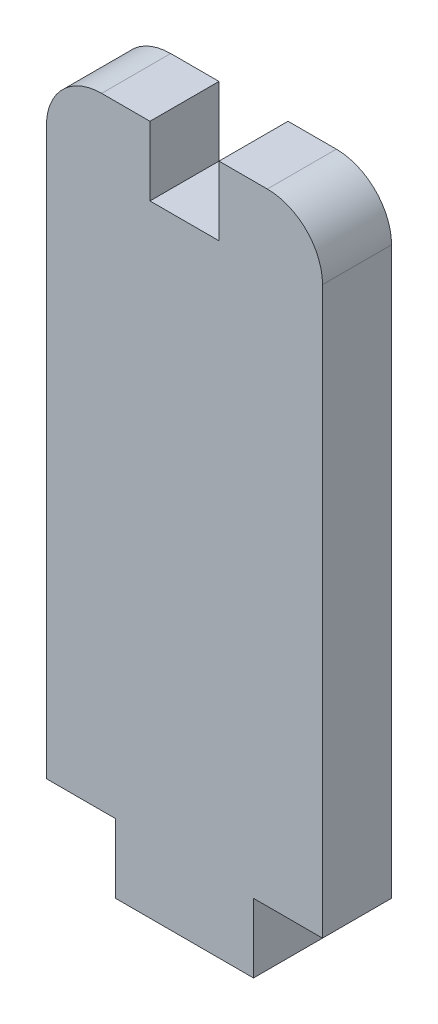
SolidWorks part; units mm, degrees
ref_plane "Front Plane" through (0, 0, 0) normal (0, 0, 1) x (1, 0, 0)
ref_plane "Top Plane" through (0, 0, 0) normal (0, 1, 0) x (1, 0, 0)
ref_plane "Right Plane" through (0, 0, 0) normal (1, 0, 0) x (0, 0, -1)
sketch "Sketch1" plane through (0, 0, 0) normal (0, 0, 1) x (1, 0, 0)
  line L1 (-6.35, 15.875) -> (6.35, 15.875)
  line L2 (-6.35, 15.875) -> (-6.35, -15.875)
  line L3 (-6.35, -15.875) -> (6.35, -15.875)
  line L4 (6.35, 15.875) -> (6.35, -15.875)
  line L5 (-6.35, 15.875) -> (6.35, -15.875) construction
  line L6 (-6.35, -15.875) -> (6.35, 15.875) construction
  point P0 (0, 0)
  dimension "D1" = 12.7
  dimension "D2" = 31.75
extrude "Boss-Extrude1" add sketch "Sketch1" along normal mid plane 3.175
sketch "Sketch2" plane through (0, 0, 1.5875) normal (0, 0, 1) x (1, 0, 0)
  line L0 (0, 17.053) -> (0, -17.5655) construction
  line L1 (-6.35, -15.875) -> (-3.175, -15.875)
  line L2 (-6.35, -15.875) -> (-6.35, -12.7)
  line L3 (-6.35, -12.7) -> (-3.175, -12.7)
  line L4 (-3.175, -15.875) -> (-3.175, -12.7)
  line L5 (3.175, -15.875) -> (3.175, -12.7)
  line L6 (6.35, -12.7) -> (3.175, -12.7)
  line L7 (6.35, -15.875) -> (6.35, -12.7)
  line L8 (6.35, -15.875) -> (3.175, -15.875)
  dimension "D1" = 3.175
  dimension "D2" = 3.175
extrude "Cut-Extrude1" cut sketch "Sketch2" against normal through all
sketch "Sketch3" plane through (0, 0, 1.5875) normal (0, 0, 1) x (1, 0, 0)
  line L0 (6.35, 15.875) -> (-6.35, 15.875) construction
  line L1 (-1.5875, 15.875) -> (1.5875, 15.875)
  line L2 (-1.5875, 15.875) -> (-1.5875, 12.7)
  line L3 (-1.5875, 12.7) -> (1.5875, 12.7)
  line L4 (1.5875, 15.875) -> (1.5875, 12.7)
  line L5 (-1.5875, 15.875) -> (1.5875, 12.7) construction
  line L6 (-1.5875, 12.7) -> (1.5875, 15.875) construction
  point P0 (0, 14.2875)
  dimension "D1" = 3.175
  dimension "D2" = 3.175
extrude "Cut-Extrude2" cut sketch "Sketch3" against normal through all
fillet "Fillet1" radius 2.54 2 edges at (6.35, 15.875, 0) (-6.35, 15.875, 0)
